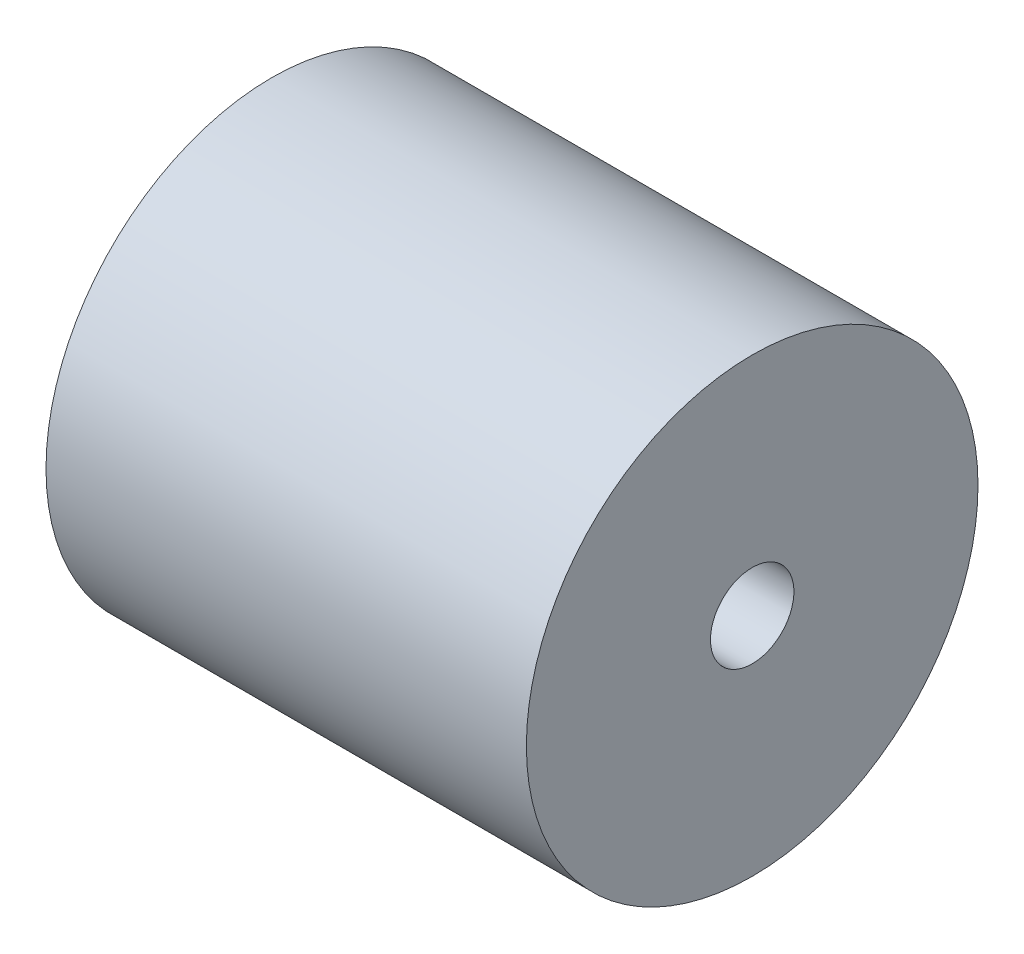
SolidWorks part; units mm, degrees
ref_plane "Vorne" through (0, 0, 0) normal (0, 0, 1) x (1, 0, 0)
ref_plane "Oben" through (0, 0, 0) normal (0, 1, 0) x (1, 0, 0)
ref_plane "Rechts" through (0, 0, 0) normal (1, 0, 0) x (0, 0, -1)
sketch "Skizze1" plane through (0, 0, 0) normal (0, 0, 1) x (1, 0, 0)
  line L0 (-18.6019, 8.7883) -> (30.6658, 8.7883)
  line L1 (30.6658, 8.7883) -> (32.7963, 5.8589)
  line L2 (32.7963, 5.8589) -> (49.8402, 5.8589)
  line L3 (49.8402, 5.8589) -> (52.4035, 7.723)
  line L4 (52.4035, 7.723) -> (70.3462, 7.723)
  line L5 (70.3462, 7.723) -> (70.3462, 41.8109)
  line L6 (70.3462, 41.8109) -> (-18.6019, 41.8109)
  line L7 (-18.6019, 41.8109) -> (-18.6019, 8.7883)
  line L8 (0, 0) -> (79.9334, 0) construction
revolve "Rotation1" add sketch "Skizze1" angle 360 about L8
